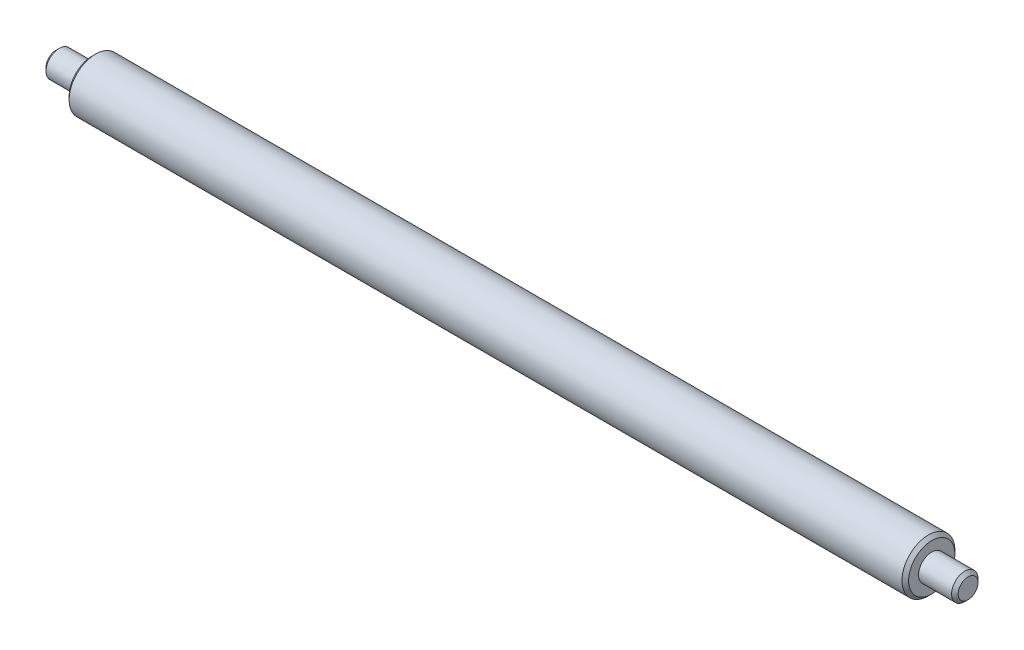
SolidWorks part; units mm, degrees
ref_plane "Plan de face" through (0, 0, 0) normal (0, 0, 1) x (1, 0, 0)
ref_plane "Plan de dessus" through (0, 0, 0) normal (0, 1, 0) x (1, 0, 0)
ref_plane "Plan de droite" through (0, 0, 0) normal (1, 0, 0) x (0, 0, -1)
sketch "Esquisse1" plane through (0, 0, 0) normal (0, 0, 1) x (1, 0, 0)
  line L0 (-138, 0) -> (138, 0)
  line L1 (138, 0) -> (138, 3)
  line L2 (127, 4) -> (137, 4)
  line L3 (127, 4) -> (127, 7)
  line L4 (126, 8) -> (-126, 8)
  line L5 (127, 7) -> (126, 8)
  line L6 (137, 4) -> (138, 3)
  line L7 (0, 0) -> (0, 12.1437) construction
  line L8 (-137, 4) -> (-138, 3)
  line L9 (-127, 7) -> (-126, 8)
  line L10 (-127, 4) -> (-127, 7)
  line L11 (-127, 4) -> (-137, 4)
  line L12 (-138, 0) -> (-138, 3)
  point P4 (138, 4)
  point P6 (127, 8)
  point P18 (-127, 8)
  point P19 (-138, 4)
  point P20 (0, 8)
  dimension "D1" = 8
  dimension "D2" = 4
  dimension "D3" = 127
  dimension "D4" = 10
revolve "Révolution1" add sketch "Esquisse1" angle 360 about L0
